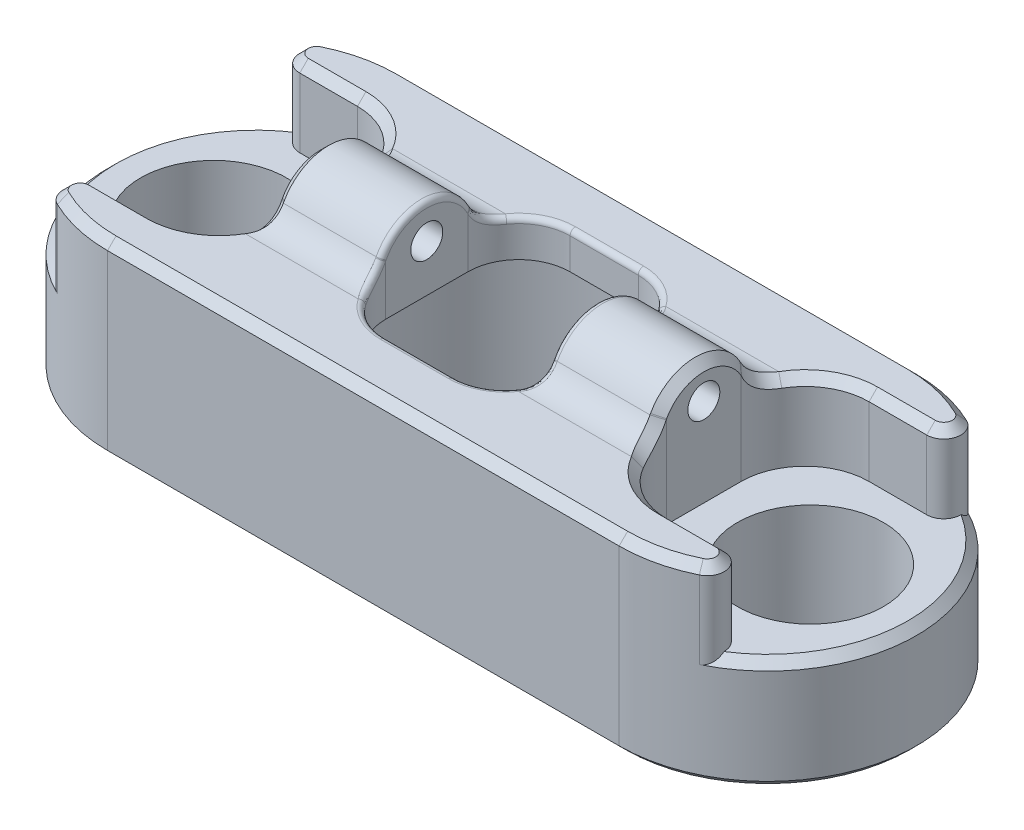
SolidWorks part; units mm, degrees
ref_plane "Front Plane" through (0, 0, 0) normal (0, 0, 1) x (1, 0, 0)
ref_plane "Top Plane" through (0, 0, 0) normal (0, 1, 0) x (1, 0, 0)
ref_plane "Right Plane" through (0, 0, 0) normal (1, 0, 0) x (0, 0, -1)
sketch "Sketch1" plane through (0, 0, 0) normal (1, 0, 0) x (0, 0, -1)
  line L0 (0, 0) -> (0, 11.8405) construction
  line L1 (-6.975, 0) -> (6.975, 0)
  line L2 (-6.975, 0) -> (-6.975, 8.82)
  line L3 (-6.975, 8.82) -> (-3.4545, 8.82)
  line L4 (6.975, 0) -> (6.975, 8.82)
  line L5 (3.4545, 8.82) -> (6.975, 8.82)
  arc A0 (2.1259, 9.6238) -> (-2.1259, 9.6238) centre (0, 8.51) ccw
  arc A1 (2.1259, 9.6238) -> (3.4545, 8.82) centre (3.4545, 10.32) ccw
  arc A2 (-3.4545, 8.82) -> (-2.1259, 9.6238) centre (-3.4545, 10.32) ccw
  circle A3 centre (0, 9.32) radius 0.8 construction
  dimension "D3" = 8.51
  dimension "D4" = 2.4
  dimension "D5" = 1.5
  dimension "D6" = 9.32
  dimension "D7" = 1.6
  dimension "D1" = 13.95
  dimension "D2" = 8.82
extrude "Boss-Extrude1" add sketch "Sketch1" along normal mid plane 37.95
sketch "Sketch2" plane through (0, 0, 0) normal (0, 1, 0) x (1, 0, 0)
  line L2 (-12, 6.975) -> (-20, 6.975)
  line L4 (-20, 6.975) -> (-20, -6.975)
  line L5 (-20, -6.975) -> (-12, -6.975)
  line L6 (18.975, -6.975) -> (-18.975, -6.975) construction
  line L8 (-18.975, 2.1259) -> (-18.975, -2.1259) construction
  line L9 (18.975, 6.975) -> (-18.975, 6.975) construction
  line L10 (18.975, 0) -> (-18.975, 0) construction
  line L11 (12, 6.975) -> (20, 6.975)
  line L12 (20, 6.975) -> (20, -6.975)
  line L13 (20, -6.975) -> (12, -6.975)
  line L15 (18.975, -2.1259) -> (18.975, 2.1259) construction
  arc A2 (-12, 6.975) -> (-12, -6.975) centre (-12, 0) ccw
  arc A3 (12, -6.975) -> (12, 6.975) centre (12, 0) ccw
  dimension "D1" = 20
extrude "Cut-Extrude1" cut sketch "Sketch2" along normal blind 38
sketch "Sketch4" plane through (0, 0, 0) normal (1, 0, 0) x (0, 0, -1)
  line L0 (-6.975, 0) -> (6.975, 0) construction
  circle A0 centre (0, 9.32) radius 0.75
  dimension "D1" = 1.5
  dimension "D2" = 9.32
extrude "Cut-Extrude2" cut sketch "Sketch4" against normal mid plane 40
ref_plane "Plane2" through (0, 10.91, 0) normal (0, 1, 0) x (1, 0, 0)
sketch "Sketch5" plane through (0, 10.91, 0) normal (0, 1, 0) x (1, 0, 0)
  line L0 (0, 4.325) -> (0, -4.325) construction
  line L1 (-1.6, 4.325) -> (1.6, 4.325)
  line L2 (-4, 1.925) -> (-4, -1.925)
  line L3 (-1.6, -4.325) -> (1.6, -4.325)
  line L4 (4, 1.925) -> (4, -1.925)
  line L5 (-4, 0) -> (4, 0) construction
  arc A0 (-1.6, 4.325) -> (-4, 1.925) centre (-1.6, 1.925) ccw
  arc A1 (-1.6, -4.325) -> (-4, -1.925) centre (-1.6, -1.925) cw
  arc A2 (1.6, -4.325) -> (4, -1.925) centre (1.6, -1.925) ccw
  arc A3 (4, 1.925) -> (1.6, 4.325) centre (1.6, 1.925) ccw
  point P11 (-4, 4.325)
  point P14 (-4, -4.325)
  point P19 (4, 4.325)
  dimension "D3" = 2.4
  dimension "D1" = 8.65
  dimension "D2" = 8
extrude "Cut-Extrude3" cut sketch "Sketch5" against normal blind 40
sketch "Sketch6" plane through (0, 0, 0) normal (0, -1, 0) x (1, 0, 0)
  circle A0 centre (0, 0) radius 6.35
  dimension "D1" = 12.7
extrude "Cut-Extrude4" cut sketch "Sketch6" against normal blind 7.11
sketch "Sketch7" plane through (0, 0, 0) normal (0, -1, 0) x (1, 0, 0)
  line L0 (-18.9346, 0) -> (-4, 0) construction
  line L1 (-8.3364, 0) -> (-17.7309, 0) construction
  circle A0 centre (-14, 0) radius 3.425
  circle A1 centre (14, 0) radius 3.425
  dimension "D1" = 28
  dimension "D3" = 6.85
  dimension "D2" = 14
extrude "Cut-Extrude5" cut sketch "Sketch7" against normal through all
ref_plane "Plane3" through (0, 5.18, 0) normal (0, -1, 0) x (-1, 0, 0)
sketch "Sketch8" plane through (0, 5.18, 0) normal (0, -1, 0) x (-1, 0, 0)
  line L0 (20, 4.75) -> (20, -4.75)
  line L1 (20, -4.75) -> (12, -4.75)
  line L2 (9, -1.75) -> (9, 1.75)
  line L3 (12, 4.75) -> (20, 4.75)
  line L4 (0, 0) -> (0, -6.975) construction
  line L5 (-12, -6.975) -> (12, -6.975) construction
  line L6 (0, 0) -> (21.3919, 0) construction
  line L7 (-20, -4.75) -> (-12, -4.75)
  line L8 (-20, 4.75) -> (-20, -4.75)
  line L9 (-12, 4.75) -> (-20, 4.75)
  line L10 (-9, -1.75) -> (-9, 1.75)
  arc A0 (12, -4.75) -> (9, -1.75) centre (12, -1.75) cw
  arc A1 (9, 1.75) -> (12, 4.75) centre (12, 1.75) cw
  arc A2 (-12, -4.75) -> (-9, -1.75) centre (-12, -1.75) ccw
  arc A3 (-9, 1.75) -> (-12, 4.75) centre (-12, 1.75) ccw
  dimension "D3" = 3
  dimension "D1" = 9.5
  dimension "D2" = 9
  dimension "D4" = 20
extrude "Cut-Extrude6" cut sketch "Sketch8" against normal through all
fillet "Fillet2" radius 0.8 4 edges at (-17.1077, 7, 4.75) (-17.1077, 7, -4.75) (17.1077, 7, 4.75) (17.1077, 7, -4.75)
chamfer "Chamfer1" distance 0.4 angle 45 2 edges at (18.975, 5.18, 0) (-18.975, 5.18, 0)
chamfer "Chamfer2" distance 0.4 angle 45 28 edges at (13.3535, 8.82, 4.75) (10.606, 8.82, 4.4065) (9.1395, 9.0513, 2.6543) (9, 10.91, 0) (9.1202, 9.0938, -2.5906) (10.606, 8.82, -4.4065) (13.3535, 8.82, -4.75) (-13.3535, 8.82, 4.75) (-10.606, 8.82, 4.4065) (-9.134, 9.0627, 2.6364) (-9, 10.91, 0) (-9.2204, 8.935, -2.8787) (-10.606, 8.82, -4.4065) (-13.3535, 8.82, -4.75) (13.5691, 8.82, -6.7962) (-13.5691, 8.82, -6.7962) (0, 8.82, -6.975) (13.5691, 8.82, 6.7962) (-13.5691, 8.82, 6.7962) (0, 8.82, 6.975) (15.4865, 8.82, -5.37) (-15.4865, 8.82, -5.37) (15.4865, 8.82, 5.37) (-15.4865, 8.82, 5.37)
fillet "Fillet1" radius 0.25 16 edges at (0, 8.82, -4.325) (-2.622, 8.82, -4.0965) (-3.8415, 8.9789, -2.7826) (-4, 10.91, 0) (-3.8995, 9.0788, 2.6123) (-2.622, 8.82, 4.0965) (0, 8.82, 4.325) (2.622, 8.82, 4.0965) (3.8415, 8.9789, 2.7826) (4, 10.91, 0) (3.8995, 9.0788, -2.6123) (2.622, 8.82, -4.0965)
chamfer "Chamfer3" distance 0.3 angle 45 4 edges at (0, 0, -6.975) (18.975, 0, 0) (-18.975, 0, 0) (0, 0, 6.975)
chamfer "Chamfer4" distance 0.25 angle 45 3 edges at (14, 0, -3.425) (0, 0, -6.35) (-14, 0, -3.425)
fillet "Fillet3" radius 0.3 1 edges at (0, 7.11, -6.35)
